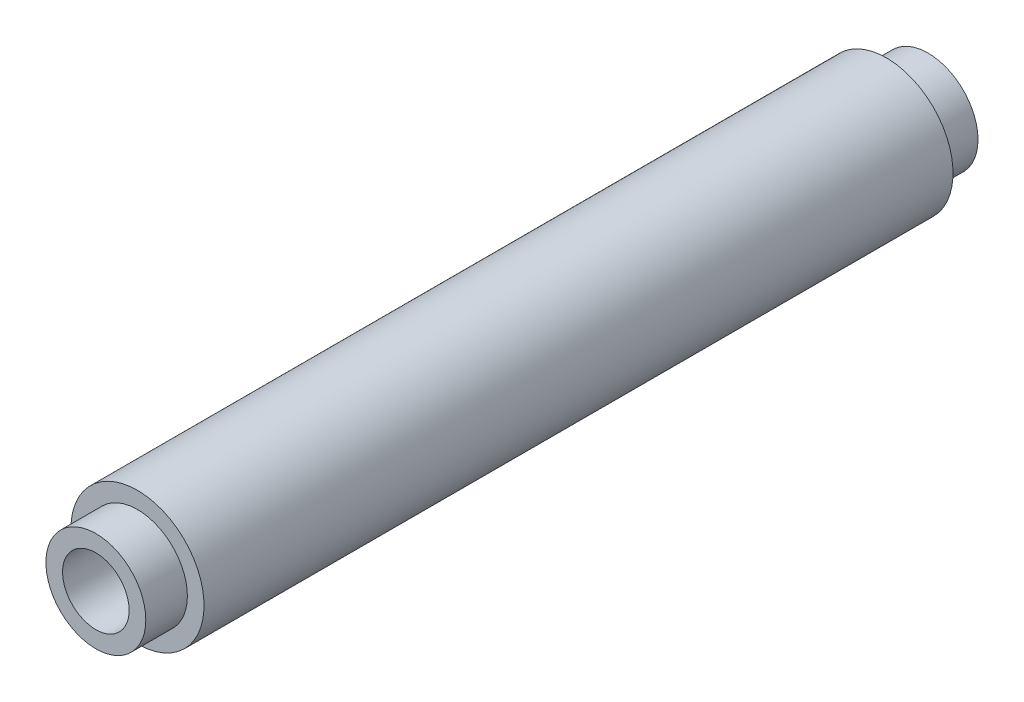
SolidWorks part; units mm, degrees
ref_plane "Front Plane" through (0, 0, 0) normal (0, 0, 1) x (1, 0, 0)
ref_plane "Top Plane" through (0, 0, 0) normal (0, 1, 0) x (1, 0, 0)
ref_plane "Right Plane" through (0, 0, 0) normal (1, 0, 0) x (0, 0, -1)
sketch "Sketch1" plane through (0, 0, 0) normal (0, 0, 1) x (1, 0, 0)
  circle A0 centre (0, 0) radius 8
  dimension "D1" = 16
extrude "Boss-Extrude1" add sketch "Sketch1" along normal blind 90
sketch "Sketch2" plane through (0, 0, 90) normal (0, 0, 1) x (1, 0, 0)
  circle A0 centre (0, 0) radius 4
  circle A1 centre (0, 0) radius 6
  dimension "D1" = 8
  dimension "D2" = 12
extrude "Boss-Extrude2" add sketch "Sketch2" along normal blind 5 and the other way blind 95
sketch "Sketch3" plane through (0, 0, 0) normal (0, 0, -1) x (-1, 0, 0)
  circle A0 centre (0, 0) radius 4
  dimension "D1" = 8
extrude "Cut-Extrude1" cut sketch "Sketch3" against normal blind 10
sketch "Sketch4" plane through (0, 0, 90) normal (0, 0, 1) x (1, 0, 0)
  circle A0 centre (0, 0) radius 4
  dimension "D1" = 8
extrude "Cut-Extrude2" cut sketch "Sketch4" against normal blind 10
